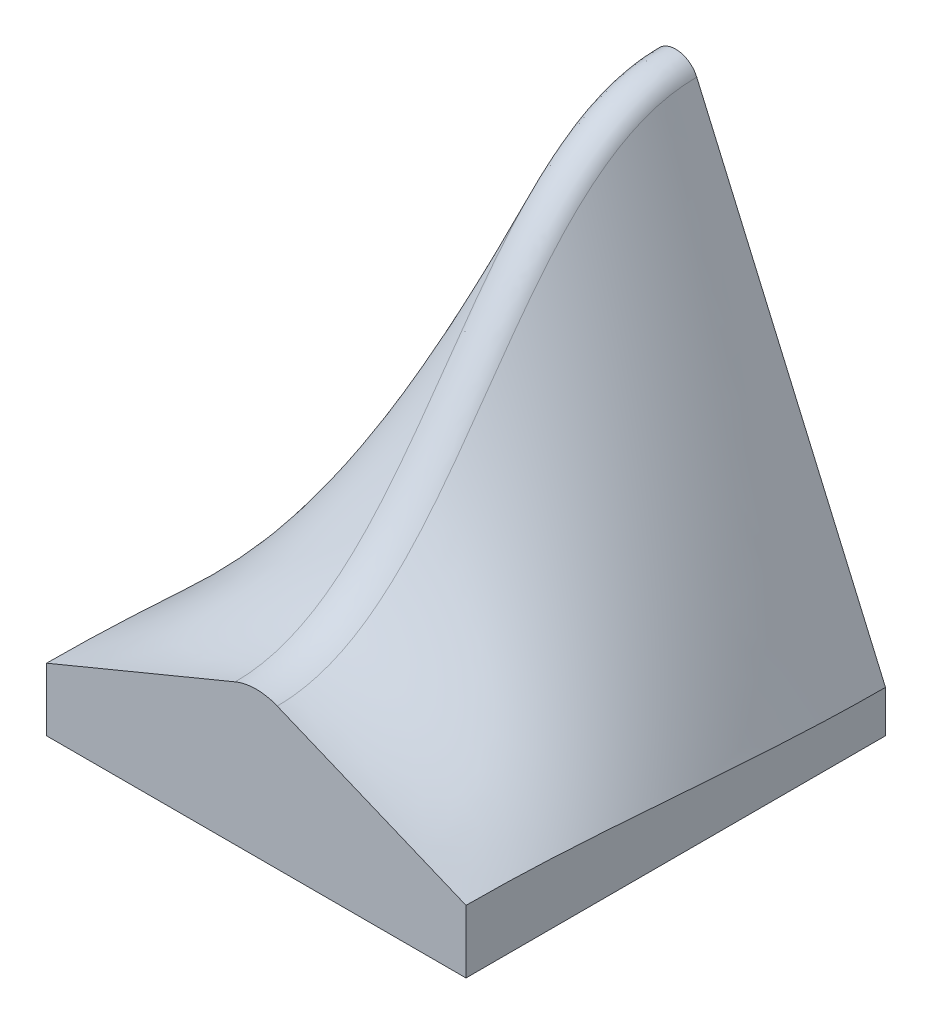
SolidWorks part; units mm, degrees
ref_plane "Front Plane" through (0, 0, 0) normal (0, 0, 1) x (1, 0, 0)
ref_plane "Top Plane" through (0, 0, 0) normal (0, 1, 0) x (1, 0, 0)
ref_plane "Right Plane" through (0, 0, 0) normal (1, 0, 0) x (0, 0, -1)
ref_plane "Plane1" through (0, 0, -50) normal (0, 0, 1) x (1, 0, 0)
sketch "Sketch1" plane through (0, 0, 0) normal (0, 0, -1) x (1, 0, 0)
  line L0 (0, -17.8553) -> (25, -7.5)
  line L1 (-25, -7.5) -> (0, -17.8553)
  line L2 (-25, -7.5) -> (-25, 0)
  line L3 (-25, 0) -> (25, 0)
  line L4 (25, -7.5) -> (25, 0)
  line L5 (0, -17.8553) -> (0, 0) construction
  dimension "D1" = 50
  dimension "D2" = 135
  dimension "D3" = 7.5
sketch "Sketch2" plane through (-1.3114, -2.4692, -50) normal (0, 0, 1) x (1, 0, 0)
  line L0 (1.3114, 64.9653) -> (26.3114, 7.4692)
  line L1 (-23.6886, 7.4692) -> (1.3114, 64.9653)
  line L2 (-23.6886, 7.4692) -> (-23.6886, 2.4692)
  line L3 (-23.6886, 2.4692) -> (26.3114, 2.4692)
  line L4 (26.3114, 7.4692) -> (26.3114, 2.4692)
  line L6 (1.3114, 64.9653) -> (1.3114, 2.4692) construction
  line L8 (-23.6886, 2.4692) -> (26.3114, 2.4692) construction
  line L9 (-23.6886, 9.9692) -> (-23.6886, 2.4692) construction
  dimension "D1" = 50
  dimension "D2" = 5
  dimension "D3" = 47
loft "Loft1" add profiles "Sketch1", "Sketch2"
fillet "Fillet1" radius 5 3 edges
